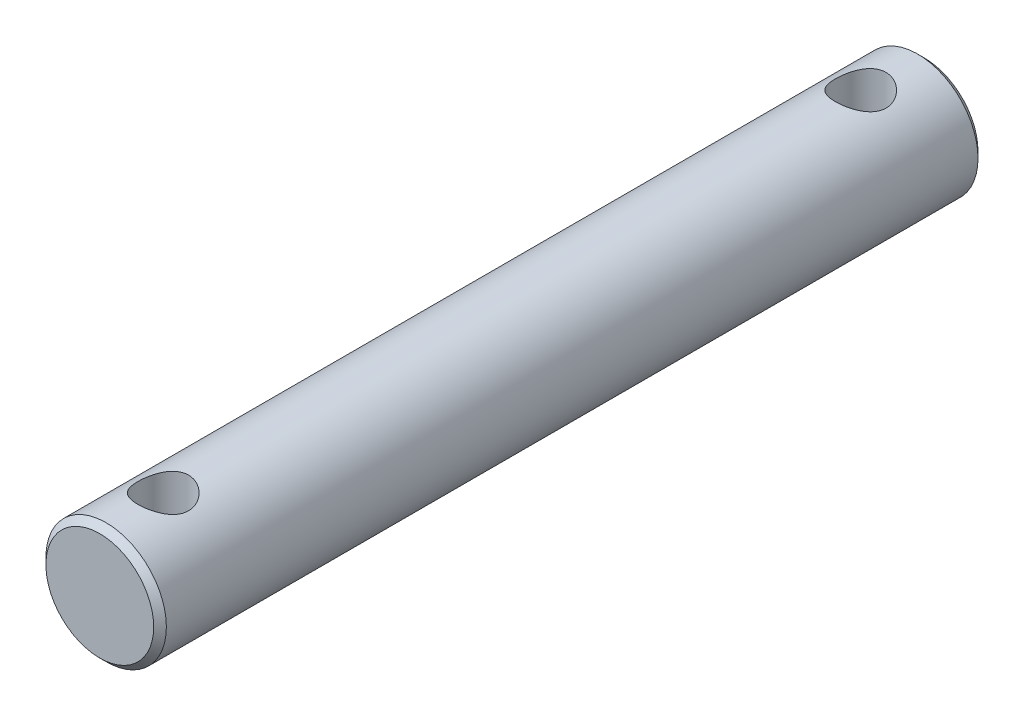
SolidWorks part; units mm, degrees
ref_plane "Plan de face" through (0, 0, 0) normal (0, 0, 1) x (1, 0, 0)
ref_plane "Plan de dessus" through (0, 0, 0) normal (0, 1, 0) x (1, 0, 0)
ref_plane "Plan de droite" through (0, 0, 0) normal (1, 0, 0) x (0, 0, -1)
sketch "Esquisse1" plane through (0, 0, 0) normal (0, 0, 1) x (1, 0, 0)
  circle A0 centre (0, 0) radius 9.5
  dimension "D1" = 19
extrude "Extrusion1" add sketch "Esquisse1" along normal blind 130
chamfer "Chanfrein1" distance 1 angle 45 2 edges at (9.5, 0, 0) (9.5, 0, 130)
sketch "Esquisse2" plane through (0, 0, 0) normal (0, 1, 0) x (1, 0, 0)
  line L0 (8.5, 0) -> (-8.5, 0) construction
  line L1 (-8.5, -130) -> (8.5, -130) construction
  circle A0 centre (0, -10) radius 4
  circle A1 centre (0, -120) radius 4
  dimension "D1" = 8
  dimension "D2" = 8
  dimension "D3" = 10
  dimension "D4" = 10
extrude "Enlèv. mat.-Extru.1" cut sketch "Esquisse2" against normal mid plane 130
